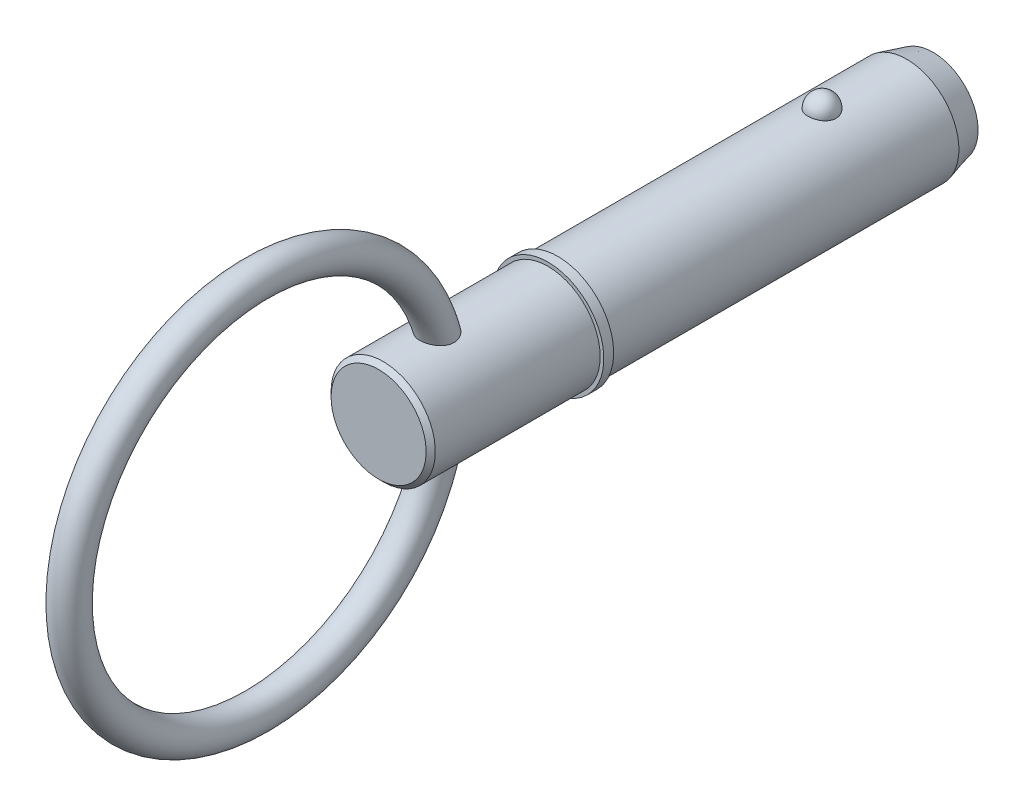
SolidWorks part; units mm, degrees
ref_plane "Front Plane" through (0, 0, 0) normal (0, 0, 1) x (1, 0, 0)
ref_plane "Top Plane" through (0, 0, 0) normal (0, 1, 0) x (1, 0, 0)
ref_plane "Right Plane" through (0, 0, 0) normal (1, 0, 0) x (0, 0, -1)
sketch "Sketch2" plane through (0, 0, 0) normal (0, 0, 1) x (1, 0, 0)
  circle A0 centre (0, 0) radius 7.94
  point P3 (0, 7.94)
  dimension "D1" = 15.88
extrude "Boss-Extrude1" add sketch "Sketch2" along normal blind 38.1
sketch "Sketch3" plane through (0, 0, 0) normal (0, 0, -1) x (-1, 0, 0)
  circle A0 centre (0, 0) radius 7.94
  dimension "D1" = 15.88
extrude "Boss-Extrude2" add sketch "Sketch3" along normal blind 19.05
chamfer "Chamfer1" distance 4 angle 15 1 edges at (-7.94, 0, -19.05)
sketch "Sketch18" plane through (0, 0, 0) normal (1, 0, 0) x (0, 0, -1)
  line L0 (15.05, 7.94) -> (-38.1, 7.94) construction
  line L1 (2.15, 10.09) -> (2.15, 5.79)
  line L2 (-38.1, -7.94) -> (15.05, -7.94) construction
  arc A0 (2.15, 10.09) -> (2.15, 5.79) centre (2.15, 7.94) ccw
  point P4 (0, 7.94)
  dimension "D1" = 18.03
revolve "Revolve1" add sketch "Sketch18" angle 360 about L1
sketch "Sketch19" plane through (0, 0, 0) normal (1, 0, 0) x (0, 0, -1)
  line L0 (-33.7288, 0) -> (-46.4542, 0) construction
sketch "Sketch20" plane through (0, 0, 0) normal (1, 0, 0) x (0, 0, -1)
  line L0 (-38.1, 0) -> (-38.1, 8.5)
  line L1 (-38.1, 7.94) -> (-38.1, -7.94) construction
  line L2 (-38.1, 8.5) -> (-39.6, 8.5)
  line L3 (-39.6, 8.5) -> (-39.6, 0)
  line L4 (-33.7288, 0) -> (-46.4542, 0) construction
  line L5 (-39.6, 0) -> (-38.1, 0)
  dimension "D1" = 8.5
  dimension "D2" = 1.5
revolve "Revolve2" add sketch "Sketch20" angle 360 about L0
sketch "Sketch21" plane through (0, 0, 38.1) normal (0, 0, -1) x (-1, 0, 0)
  circle A0 centre (0, 0) radius 7.94
  dimension "D1" = 15.88
extrude "Boss-Extrude3" add sketch "Sketch21" against normal blind 27.31
chamfer "Chamfer2" distance 0.7 angle 45 1 edges at (-7.94, 0, 65.41)
sketch "Sketch23" plane through (0, 0, 0) normal (1, 0, 0) x (0, 0, -1)
  line L0 (-65.41, 7.24) -> (-65.41, -7.24) construction
  circle A0 centre (-83.985, 0) radius 28.575
  point P2 (-55.41, 0)
  dimension "D1" = 57.15
  dimension "D2" = 10
sketch "Sketch24" plane through (0, 0, 0) normal (0, 1, 0) x (1, 0, 0)
  circle A0 centre (0, -55.41) radius 2.5
  dimension "D1" = 5
sweep "Sweep1" add profiles "Sketch24" path "Sketch23"
